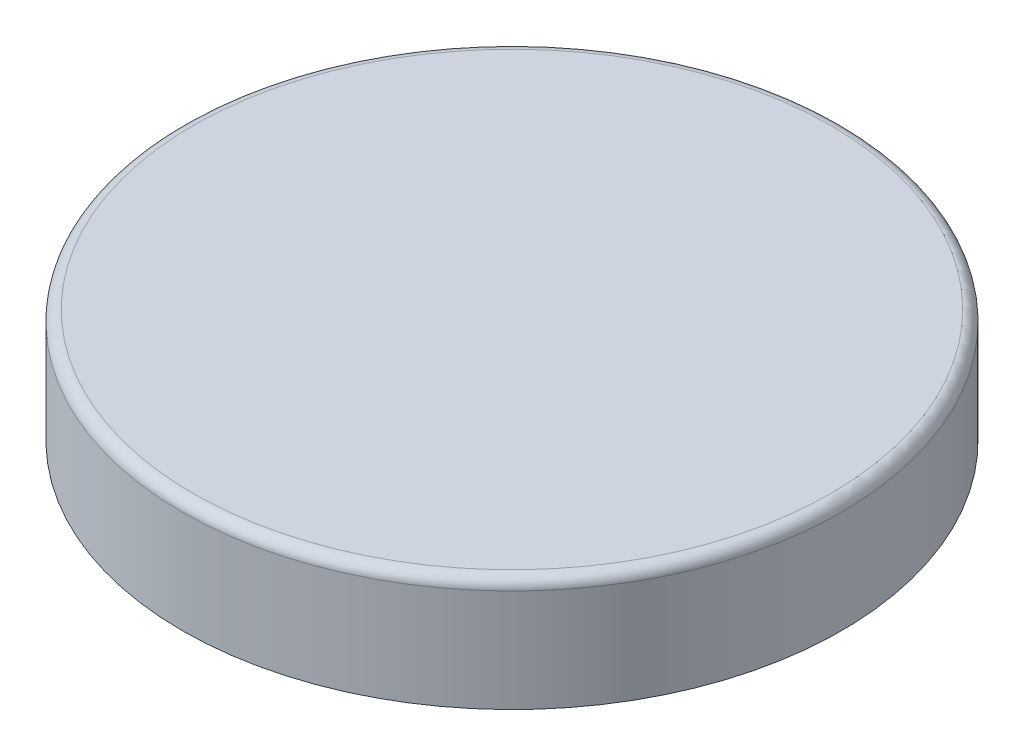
SolidWorks part; units mm, degrees
ref_plane "Plan de face" through (0, 0, 0) normal (0, 0, 1) x (1, 0, 0)
ref_plane "Plan de dessus" through (0, 0, 0) normal (0, 1, 0) x (1, 0, 0)
ref_plane "Plan de coté" through (0, 0, 0) normal (1, 0, 0) x (0, 0, -1)
sketch "Esquisse1" plane through (0, 0, 0) normal (0, 0, 1) x (1, 0, 0)
  line L0 (0, 0) -> (0, 23.2039) construction
  line L1 (0, 21) -> (59, 21)
  line L2 (61, 19) -> (61, 0)
  arc A0 (59, 21) -> (61, 19) centre (59, 19) cw
  dimension "D3" = 2
  dimension "D1" = 122
  dimension "D2" = 21
revolve "Révol.-Mince1" add sketch "Esquisse1" angle 360 about L0
sketch "Esquisse2" plane through (0, 19.5, 0) normal (0, -1, 0) x (1, 0, 0)
  circle A0 centre (0, 0) radius 59 construction
  circle A1 centre (0, 0) radius 59
  circle A2 centre (0, 0) radius 2.5
  dimension "D1" = 5
extrude "Boss.-Extru.1" add sketch "Esquisse2" along normal blind 0.1 separate body
sketch "Esquisse3" plane through (0, 19.5, 0) normal (0, -1, 0) x (1, 0, 0)
  circle A0 centre (0, 0) radius 2
  dimension "D1" = 4
extrude "Boss.-Extru.2" add sketch "Esquisse3" along normal blind 10
sketch "Esquisse4" plane through (0, 0, 0) normal (0, 0, 1) x (1, 0, 0)
  line L0 (1.5, 9.5) -> (2, 9.7887)
  line L1 (-2, 9.5) -> (2, 9.5) construction
  line L2 (2, 9.5) -> (2, 19.5) construction
  line L3 (2, 9.7887) -> (2, 9.2113)
  line L4 (2, 9.2113) -> (1.5, 9.5)
  line L5 (0, 0) -> (0, 10.9431) construction
  dimension "D1" = 60
  dimension "D2" = 3
revolve "Enlèvement de matière-Révolution1" cut sketch "Esquisse4" angle 360 about L5
pattern_linear "Répétition linéaire1" count 22 spacing 0.45 along (0, 1, 0) of "Enlèvement de matière-Révolution1"
